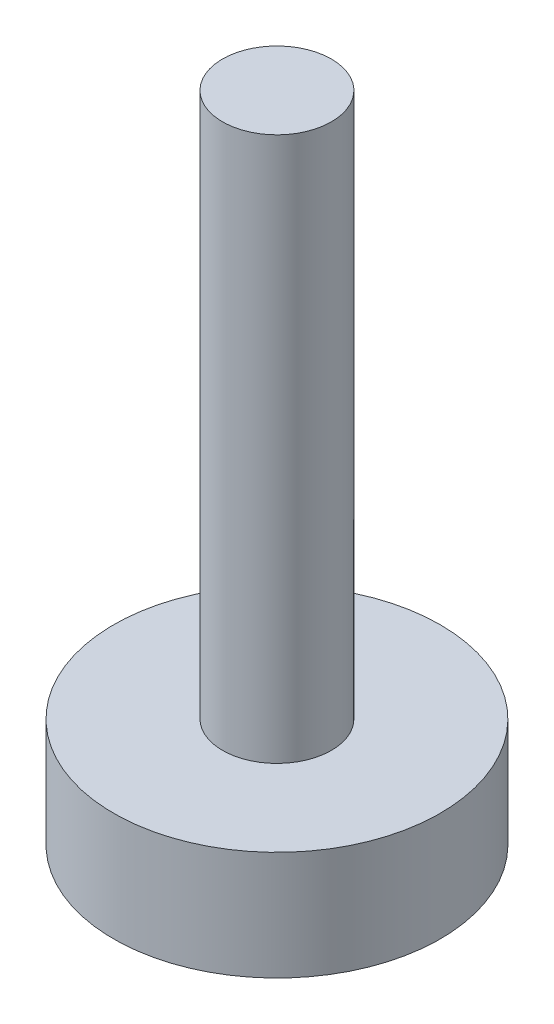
SolidWorks part; units mm, degrees
ref_plane "Front Plane" through (0, 0, 0) normal (0, 0, 1) x (1, 0, 0)
ref_plane "Top Plane" through (0, 0, 0) normal (0, 1, 0) x (1, 0, 0)
ref_plane "Right Plane" through (0, 0, 0) normal (1, 0, 0) x (0, 0, -1)
sketch "Sketch1" plane through (0, 0, 0) normal (0, 0, 1) x (1, 0, 0)
  line L0 (0, 0) -> (0, 76.2) construction
  line L1 (0, 0) -> (19.05, 0)
  line L2 (19.05, 0) -> (19.05, 12.7)
  line L3 (19.05, 12.7) -> (6.35, 12.7)
  line L4 (6.35, 12.7) -> (6.35, 76.2)
  line L5 (6.35, 76.2) -> (0, 76.2)
  line L6 (0, 0) -> (0, 76.2)
  dimension "D1" = 38.1
  dimension "D2" = 12.7
  dimension "D3" = 12.7
  dimension "D4" = 76.2
revolve "Revolve1" add sketch "Sketch1" angle 360 about L0
